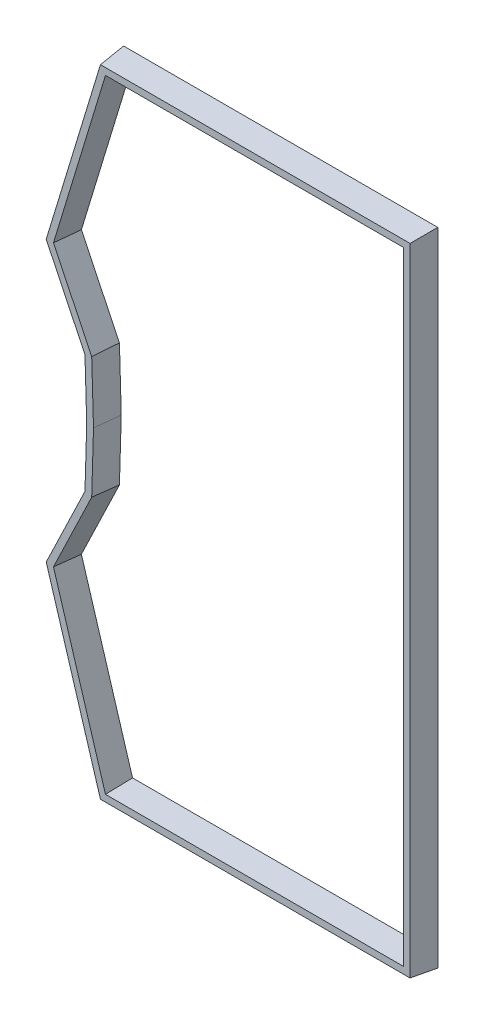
SolidWorks part; units mm, degrees
ref_plane "Front Plane" through (0, 0, 0) normal (0, 0, 1) x (1, 0, 0)
ref_plane "Top Plane" through (0, 0, 0) normal (0, 1, 0) x (1, 0, 0)
ref_plane "Right Plane" through (0, 0, 0) normal (1, 0, 0) x (0, 0, -1)
sketch "Sketch1" plane through (0, 0, 0) normal (0, 0, 1) x (1, 0, 0)
  line L18 (14.4544, 28.6788) -> (10.6689, 20.8094)
  line L19 (14.6362, 34.8006) -> (14.4544, 28.6788)
  line L20 (14.4544, 40.9223) -> (14.6362, 34.8006)
  line L21 (10.6689, 48.7917) -> (14.4544, 40.9223)
  line L22 (15.7591, 65.5309) -> (10.6689, 48.7917)
  line L23 (44.9491, 65.5309) -> (15.7591, 65.5309)
  line L24 (44.9491, 4.0702) -> (44.9491, 65.5309)
  line L25 (15.7591, 4.0702) -> (44.9491, 4.0702)
  line L26 (10.6689, 20.8094) -> (15.7591, 4.0702)
  line L36 (13.2625, 40.6319) -> (13.4356, 34.8006)
  line L37 (13.4356, 34.8006) -> (13.2625, 28.9693)
  line L38 (13.2625, 28.9693) -> (9.3847, 20.9079)
  line L39 (9.3847, 20.9079) -> (14.8697, 2.8702)
  line L40 (14.8697, 2.8702) -> (46.1491, 2.8702)
  line L41 (46.1491, 2.8702) -> (46.1491, 66.7309)
  line L42 (46.1491, 66.7309) -> (14.8697, 66.7309)
  line L43 (14.8697, 66.7309) -> (9.3847, 48.6932)
  line L44 (9.3847, 48.6932) -> (13.2625, 40.6319)
extrude "Boss-Extrude1" add sketch "Sketch1" along normal blind 2.5 draft 6
